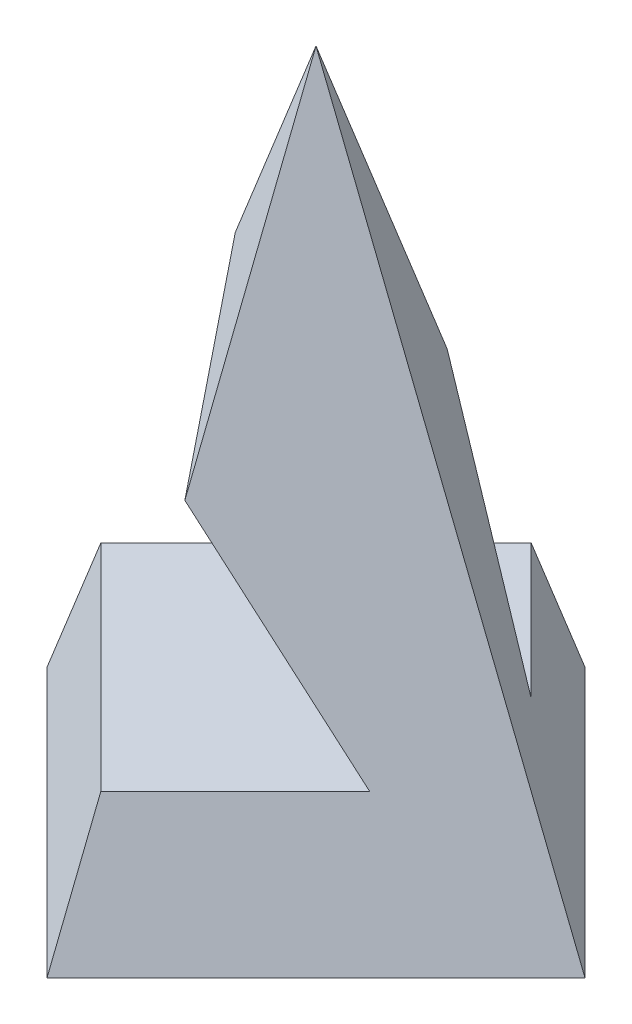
SolidWorks part; units mm, degrees
ref_plane "前视基准面" through (0, 0, 0) normal (0, 0, 1) x (1, 0, 0)
ref_plane "上视基准面" through (0, 0, 0) normal (0, 1, 0) x (1, 0, 0)
ref_plane "右视基准面" through (0, 0, 0) normal (1, 0, 0) x (0, 0, -1)
sketch "草图1" plane through (0, 0, 0) normal (0, 1, 0) x (1, 0, 0)
  line L1 (0, -16) -> (16, 0)
  line L2 (16, 0) -> (0, 16)
  line L3 (0, 16) -> (-16, 0)
  line L4 (-16, 0) -> (0, -16)
  circle A0 centre (0, 0) radius 11.3137 construction
  dimension "D1" = 32
ref_plane "基准面1" through (0, 40, 0) normal (0, 1, 0) x (-1, 0, 0)
sketch "草图2" plane through (0, 40, 0) normal (0, 1, 0) x (-1, 0, 0)
  point P0 (0, 0)
loft "放样1" add profiles "草图2", "草图1"
sketch "草图3" plane through (0, 0, 0) normal (0, 0, 1) x (1, 0, 0)
  line L0 (-15.5303, 8) -> (8, 8)
  line L1 (8, 8) -> (-7.1831, 31.7236)
  line L2 (0, 40) -> (-16, 0) construction
  line L3 (-16, 0) -> (0, 0) construction
  line L4 (0, 40) -> (0, 0) construction
  point P2 (-4.8, 28)
  dimension "D1" = 8
  dimension "D2" = 28
  dimension "D3" = 8
extrude "切除-拉伸1" cut sketch "草图3" against normal through all and the other way through all
